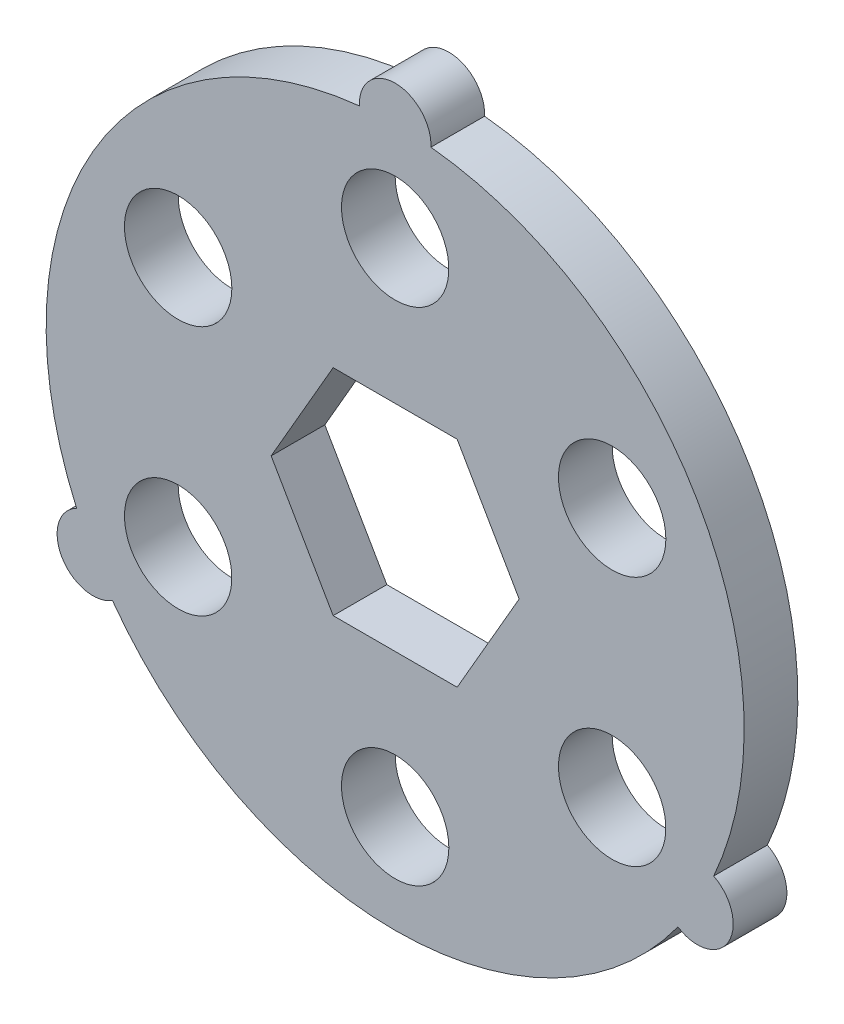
SolidWorks part; units mm, degrees
ref_plane "Plan1" through (0, 0, 0) normal (0, 0, 1) x (1, 0, 0)
ref_plane "Plan2" through (0, 0, 0) normal (0, 1, 0) x (1, 0, 0)
ref_plane "Plan3" through (0, 0, 0) normal (1, 0, 0) x (0, 0, -1)
sketch "Esquisse1" plane through (0, 0, 0) normal (0, 0, 1) x (1, 0, 0)
  line L1 (3.4641, 0) -> (1.7321, 3)
  line L2 (1.7321, 3) -> (-1.7321, 3)
  line L3 (-1.7321, 3) -> (-3.4641, 0)
  line L4 (-3.4641, 0) -> (-1.7321, -3)
  line L5 (-1.7321, -3) -> (1.7321, -3)
  line L6 (1.7321, -3) -> (3.4641, 0)
  line L7 (50, 0) -> (-50, 0) construction
  circle A0 centre (0, 0) radius 9.75
  circle A1 centre (0, 0) radius 3 construction
  dimension "D1" = 19.5
  dimension "D2" = 6
extrude "Base-Extrusion" add sketch "Esquisse1" along normal mid plane 1.5
sketch "Esquisse2" plane through (0, 0, 0.75) normal (0, 0, 1) x (1, 0, 0)
  line L5 (0, 0) -> (-5.2729, 3.0443) construction
  line L6 (-1.7321, 3) -> (-3.4641, 0) construction
  circle A0 centre (-6.0622, 3.5) radius 1.5
  dimension "D1" = 3
  dimension "D2" = 7
extrude "Enlèv. mat.-Extru.1" cut sketch "Esquisse2" against normal through all
pattern_circular "Répétition circulaire1" count 6 over 360
sketch "Esquisse3" plane through (0, 0, 0.75) normal (0, 0, 1) x (1, 0, 0)
  circle A0 centre (0, 9.75) radius 1
  circle A1 centre (0, 0) radius 9.75 construction
  dimension "D1" = 2
extrude "Boss.-Extru.1" add sketch "Esquisse3" against normal up to surface (1.5 mm away)
pattern_circular "Répétition circulaire2" count 3 over 360
